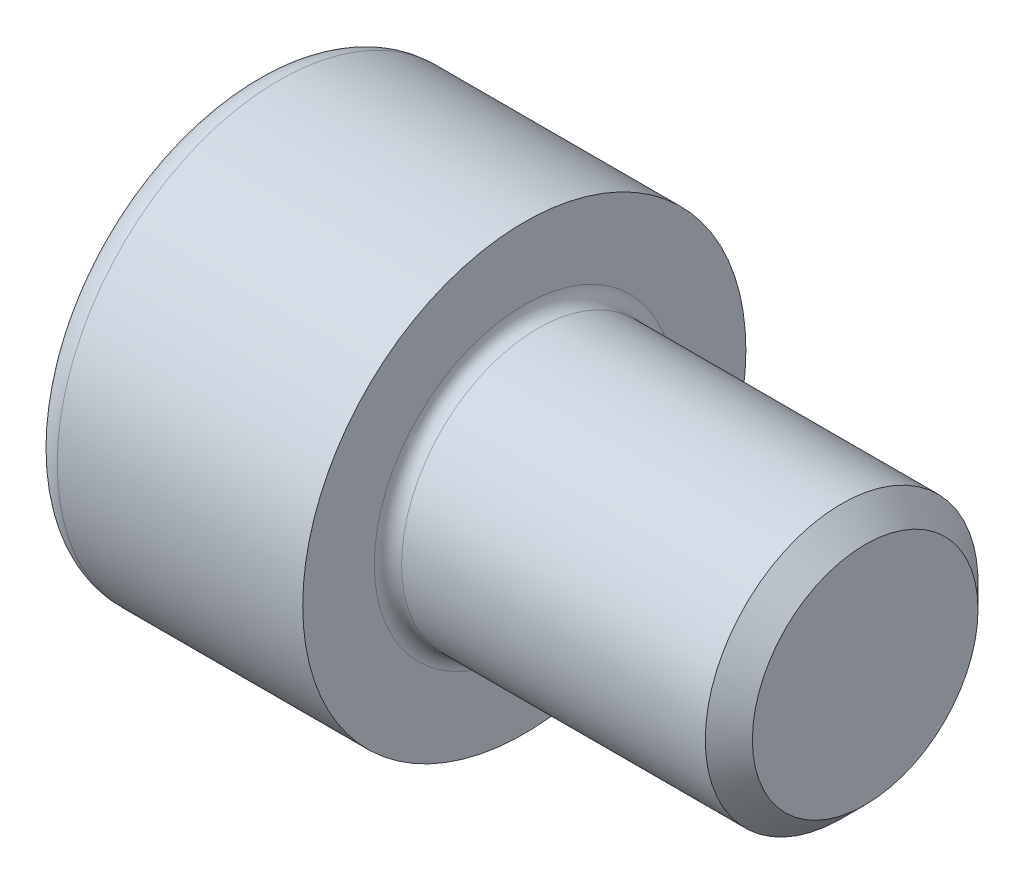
SolidWorks part; units mm, degrees
revolve "Base-Revolve" add sketch "BodySke" angle 360 about L6
sketch "BodySke" plane through (0, 0, 0) normal (0, 0, 1) x (1, 0, 0)
  line L0 (0, 0) -> (0, 6.5)
  line L1 (0, 6.5) -> (8, 6.5)
  line L2 (8, 6.5) -> (8, 4)
  line L3 (8, 4) -> (17.3095, 4)
  line L4 (18, 3.3095) -> (18, 0)
  line L5 (18, 0) -> (0, 0)
  line L6 (-31.75, 0) -> (127, 0) construction
  line L8 (18, 3.3095) -> (17.3095, 4)
  line L10 (18, -3.3095) -> (17.3095, -4) construction
  line L11 (9.25, 9.525) -> (9.25, 3.175) construction
  line L12 (8, 9.525) -> (8, 3.175) construction
  line L13 (-42, 9.525) -> (-42, 3.175) construction
  dimension "Diameter" = 8
  dimension "Head_ht" = 8
  dimension "Length" = 10
  dimension "Body_ch_ang" = 45
  dimension "Head_dia" = 13
  dimension "Minor_dia" = 6.619
  dimension "Advance" = 1.25
  dimension "Thread_nom" = 10
  dimension "Thread_length" = 60
fillet "Fillet2" radius 0.8 1 edges at (0, 0, 6.5)
ref_plane "Plane1" through (0, 0, 0) normal (0, 0, 1) x (1, 0, 0)
ref_plane "Plane2" through (0, 0, 0) normal (0, 1, 0) x (1, 0, 0)
ref_plane "Plane3" through (0, 0, 0) normal (1, 0, 0) x (0, 0, -1)
fillet "Fillet1" radius 0.4 1 edges at (8, 0, 4)
sketch "Sketch2" plane through (0, 0, 0) normal (0, 0, 1) x (1, 0, 0)
  line L0 (0, 3.01) -> (4, 3.01)
  line L1 (4, 3.01) -> (5.7378, 0)
  line L2 (-31.75, 0) -> (127, 0) construction
  line L3 (5.7378, 0) -> (0, 0)
  line L4 (0, 0) -> (0, 3.01)
  line L6 (0, 0) -> (47.625, 0) construction
revolve "Hex-PreBroach" cut sketch "Sketch2" angle 360 about L6
sketch "Sketch3" plane through (0, 0, 0) normal (-1, 0, 0) x (0, 0.5, 0.866)
  line L0 (1.7378, 3.01) -> (-1.7378, 3.01)
  line L1 (-1.7378, 3.01) -> (-3.4756, 0)
  line L2 (1.7378, 3.01) -> (3.4756, 0)
  line L3 (1.7378, -3.01) -> (3.4756, 0)
  line L4 (1.7378, -3.01) -> (-1.7378, -3.01)
  line L5 (-1.7378, -3.01) -> (-3.4756, 0)
extrude "Hex" cut sketch "Sketch3" against normal blind 4
sketch "ThdSchSke" plane through (0, 0, 0) normal (0, 0, 1) x (1, 0, 0)
  line L0 (11.75, -3.3095) -> (11.2665, -4)
  line L1 (11.75, -3.3095) -> (12.2335, -4)
  line L2 (12.2335, -4) -> (12.2335, -5)
  line L3 (-3.175, 0) -> (5.1513, 0) construction
  line L4 (0, 5.7) -> (0, -5.7) construction
  line L5 (12.2335, -5) -> (11.2665, -5)
  line L6 (11.2665, -5) -> (11.2665, -4)
revolve "ThreadSchematic" [suppressed] cut sketch "ThdSchSke" angle 360 about L3
pattern_linear "ThdSchPat" [suppressed]
thread "Filetage1" pitch 1.25 start angle 0, offset 5, length 0, pitch 1.25, diameter 8
ref_plane "Plan1" through (22.3095, 0, 4) normal (0, -1, 0) x (0, 0, 1)
sketch "Profil de filetage1" plane through (22.3095, 0, 4) normal (0, -1, 0) x (0, 0, 1)
  line L0 (0, 0) -> (0, 1.25) construction
  line L11 (0, 0) -> (0, 1.0937)
  line L12 (0, 1.0937) -> (-0.6766, 0.7031)
  line L13 (-0.6766, 0.7031) -> (-0.6766, 0.3906)
  line L15 (-0.6766, 0.3906) -> (0, 0)
  line L17 (-0.6766, 0.5469) -> (0, 0.5469) construction
  point P2 (0, 0)
  dimension "Pitch" = 1.25
  dimension "Profile_Angle" = 60
  dimension "Profile_Land" = 0.3125
  dimension "Profile_Height" = 0.6766
equation "\"D2@Sketch3\" = \"Hex_size@Sketch3\" / 2"
equation "\"D1@Sketch3\" = \"Hex_size@Sketch3\" / 2"
equation "\"D1@Sketch2\" = \"Hex_size@Sketch3\" / 2"
equation "\"Depth@Sketch2\" =  \"Key_eng@Hex\""
equation "\"Thread_minor@ThdSchSke\" = \"Minor_dia@BodySke\""
equation "\"Diameter@ThdSchSke\" = \"Diameter@BodySke\""
equation "\"Overcut@ThdSchSke\" = \"Diameter@BodySke\" * 1.25"
